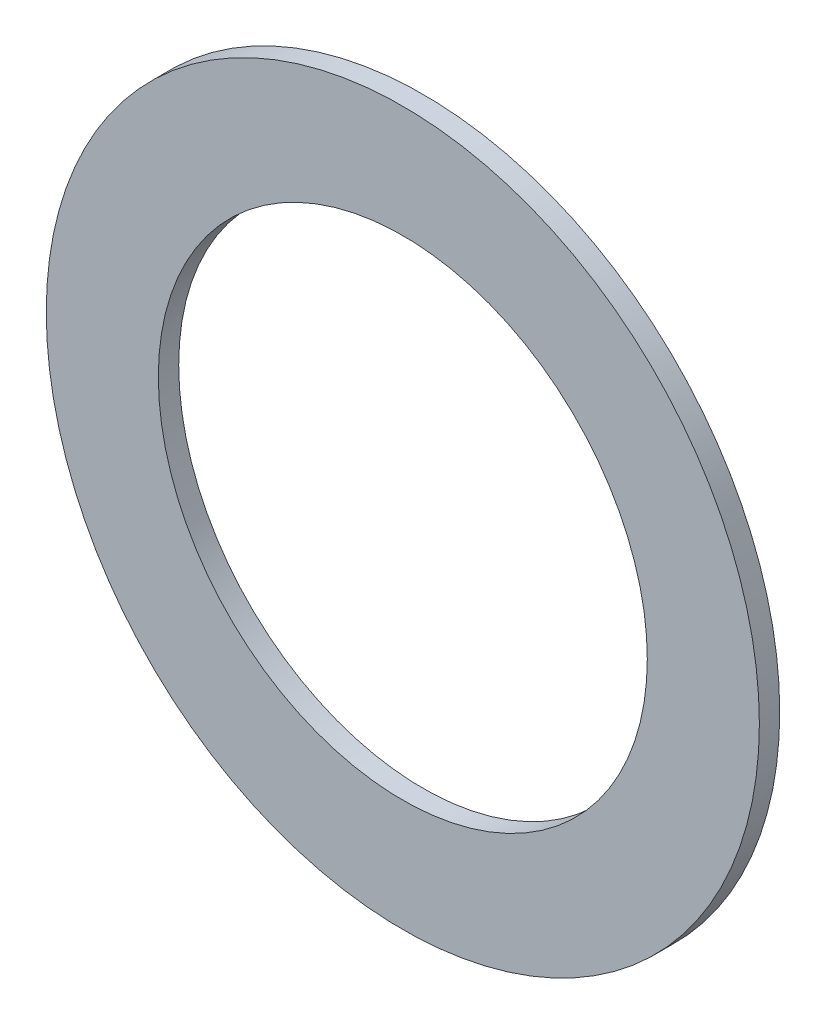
SolidWorks part; units mm, degrees
ref_plane "Plan1" through (0, 0, 0) normal (0, 0, 1) x (1, 0, 0)
ref_plane "Plan2" through (0, 0, 0) normal (0, 1, 0) x (1, 0, 0)
ref_plane "Plan3" through (0, 0, 0) normal (1, 0, 0) x (0, 0, -1)
sketch "Esquisse1" plane through (0, 0, 0) normal (0, 0, 1) x (1, 0, 0)
  circle A0 centre (0, 0) radius 35
  circle A1 centre (0, 0) radius 24
  dimension "D1" = 70
  dimension "D2" = 48
extrude "Base-Extrusion" add sketch "Esquisse1" along normal blind 2
